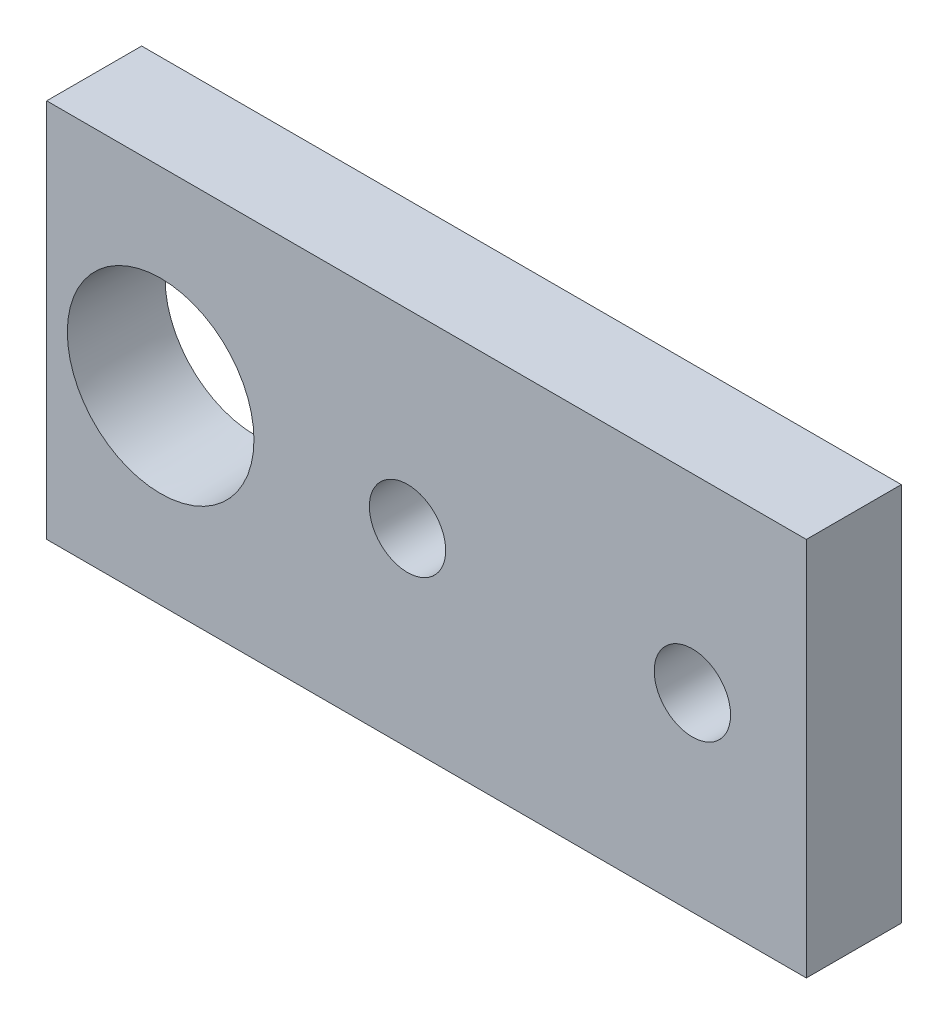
SolidWorks part; units mm, degrees
ref_plane "Front Plane" through (0, 0, 0) normal (0, 0, 1) x (1, 0, 0)
ref_plane "Top Plane" through (0, 0, 0) normal (0, 1, 0) x (1, 0, 0)
ref_plane "Right Plane" through (0, 0, 0) normal (1, 0, 0) x (0, 0, -1)
sketch "Sketch1" plane through (0, 0, 0) normal (0, 0, 1) x (1, 0, 0)
  line L1 (0, 0) -> (50.8, 0)
  line L2 (0, 0) -> (0, 25.4)
  line L3 (0, 25.4) -> (50.8, 25.4)
  line L4 (50.8, 0) -> (50.8, 25.4)
  dimension "D1" = 25.4
  dimension "D2" = 50.8
extrude "Extrude1" add sketch "Sketch1" along normal blind 6.35
sketch "Sketch2" plane through (0, 0, 6.35) normal (0, 0, 1) x (1, 0, 0)
  line L0 (50.8, 25.4) -> (0, 25.4) construction
  line L1 (0, 25.4) -> (0, 0) construction
  circle A0 centre (7.62, 12.7) radius 6.731
  dimension "D1" = 13.462
  dimension "D2" = 12.7
  dimension "D3" = 7.62
sketch "Sketch3" plane through (0, 0, 6.35) normal (0, 0, 1) x (1, 0, 0)
  line L0 (50.8, 0) -> (50.8, 25.4) construction
  line L1 (0, 0) -> (50.8, 0) construction
  circle A0 centre (24.13, 12.7) radius 2.5527
  circle A1 centre (43.18, 12.7) radius 2.5527
  dimension "D1" = 5.1054
  dimension "D2" = 5.1054
  dimension "D4" = 19.05
  dimension "D5" = 12.7
  dimension "D3" = 7.62
extrude "Cut-Extrude2" cut sketch "Sketch3" against normal through all
hole_wizard "1/4 NPT Tapped Hole1" positions "3DSketch1" profile "Sketch4" size "1/4" standard "Ansi Inch"
sketch3d "3DSketch1"
  point P0 (7.62, 12.7, 6.35)
sketch "Sketch4" plane through (7.62, 12.7, 6.35) normal (1, 0, 0) x (0, -1, 0)
  line L0 (0, 0) -> (0, 6.35)
  line L1 (0, 6.35) -> (5.5626, 6.35)
  line L2 (-5.9437, 9.906) -> (-6.2403, 0) construction
  line L3 (5.5626, 6.35) -> (5.5626, 9.906)
  line L4 (5.5626, 9.906) -> (5.9437, 9.906)
  line L5 (5.9437, 9.906) -> (6.2403, 0)
  line L7 (6.2403, 0) -> (0, 0)
  line L8 (0, -6.35) -> (0, 107.95) construction
  line L11 (-5.5626, 9.906) -> (-5.9437, 9.906) construction
  dimension "Thru Tap Drill Dia." = 11.1252
  dimension "Thru Tap Drill Depth" = 6.35
  dimension "Thread Dia." = 12.4806
  dimension "Thread Angle" = 3.43
  dimension "Thread Depth" = 9.906
